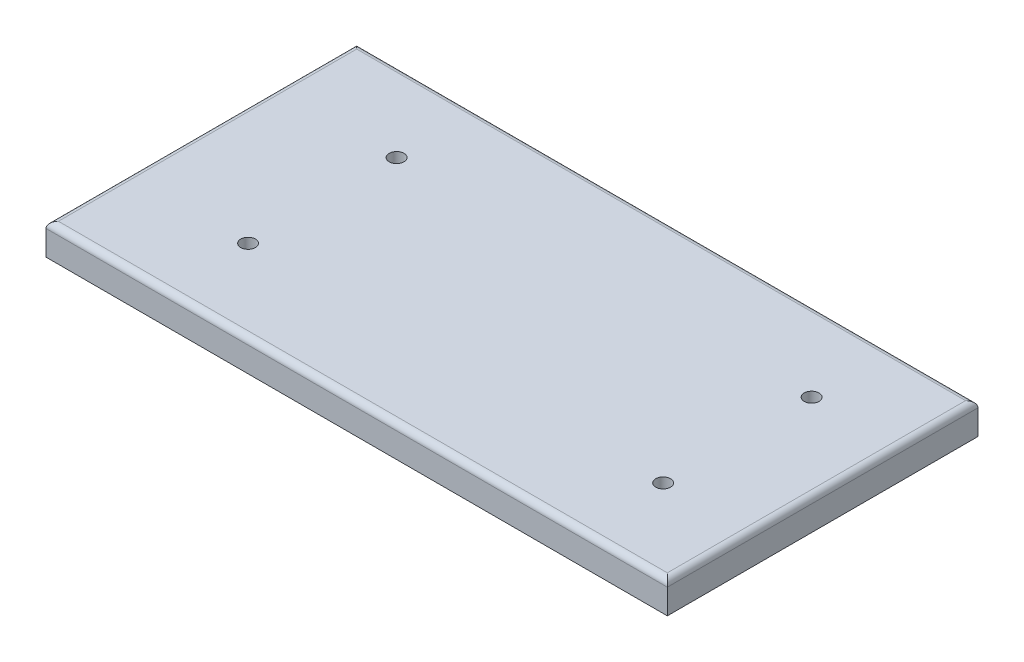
SolidWorks part; units mm, degrees
ref_plane "Front Plane" through (0, 0, 0) normal (0, 0, 1) x (1, 0, 0)
ref_plane "Top Plane" through (0, 0, 0) normal (0, 1, 0) x (1, 0, 0)
ref_plane "Right Plane" through (0, 0, 0) normal (1, 0, 0) x (0, 0, -1)
sketch "Sketch1"
  dimension "D1" = 254
  dimension "D2" = 127
extrude "Extrude1" add sketch "Sketch1" along normal blind 12.7
fillet "Fillet1" radius 2.54 4 edges at (-127, 12.7, 0) (0, 12.7, -63.5) (-127, 12.7, -127) (-254, 12.7, -63.5)
hole_wizard "B (0.238) Diameter Hole1" positions "3DSketch1" profile "Sketch3" hole size "B" standard "Ansi Inch"
sketch3d "3DSketch1"
  dimension "D1" = 60.706
  dimension "D2" = 169.672
sketch "Sketch3"
  dimension "Hole Dia." = 6.0452
  dimension "Hole Depth" = 25.4
  dimension "Drill Angle" = 118
